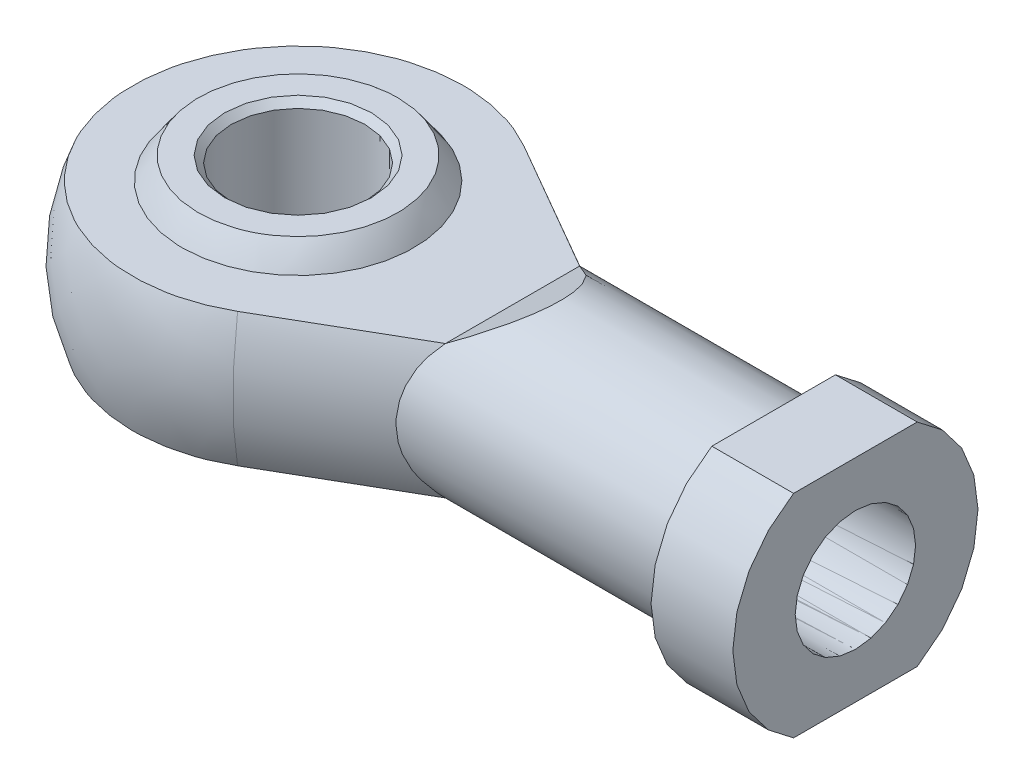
SolidWorks part; units mm, degrees
ref_plane "Plan de face" through (0, 0, 0) normal (0, 0, 1) x (1, 0, 0)
ref_plane "Plan de dessus" through (0, 0, 0) normal (0, 1, 0) x (1, 0, 0)
ref_plane "Plan de droite" through (0, 0, 0) normal (1, 0, 0) x (0, 0, -1)
imported_body "Importée1"
hole_wizard "Trou taraudé M12x1.251" positions "Esquisse2" profile "Esquisse1" tap size "M12x1.25" standard "ISO"
sketch "Esquisse2" plane through (0, 0, 0) normal (1, 0, 0) x (0, 0, -1)
  arc A0 (5.5453, -9.5) -> (5.5453, 9.5) centre (0, 0) ccw construction
  point P0 (0, 0)
sketch "Esquisse1" plane through (0, 0, 0) normal (0, 1, 0) x (0, 0, -1)
  line L0 (0, 0) -> (0, 33.4946)
  line L1 (0, 33.4946) -> (5.4, 30.25)
  line L2 (5.4, 30.25) -> (5.4, 0)
  line L5 (5.4, 0) -> (0, 0)
  line L10 (0, 33.4946) -> (-5.4, 30.25) construction
  line L11 (0, -6.35) -> (0, 107.95) construction
  dimension "Diamètre du trou pour taraudage" = 10.8
  dimension "Profondeur du trou pour taraudage" = 30.25
  dimension "Angle de pointe" = 118
